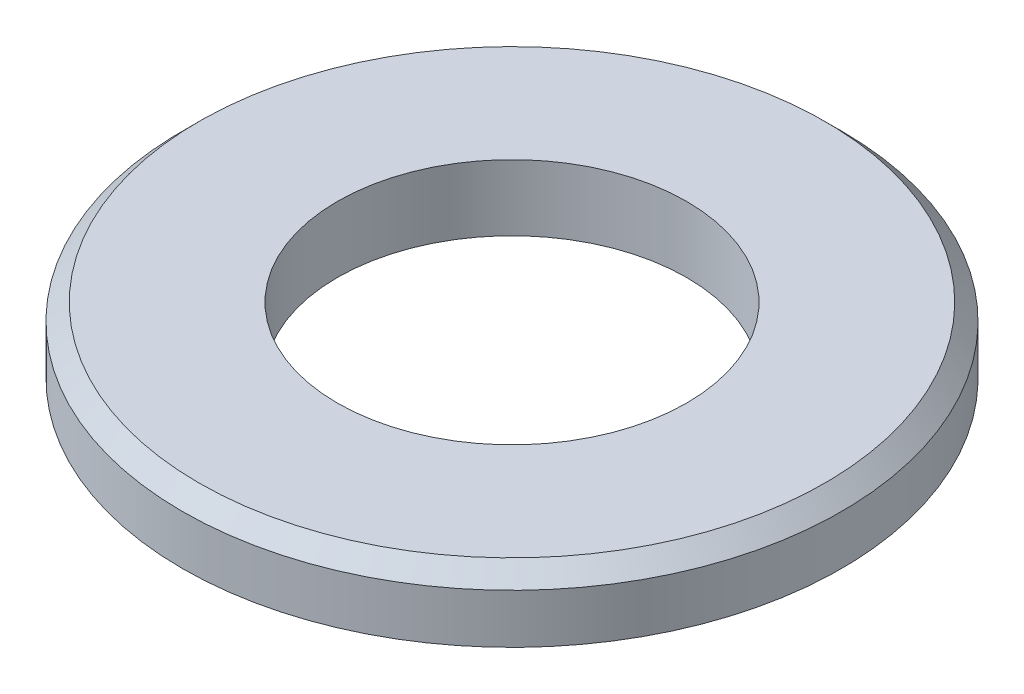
SolidWorks part; units mm, degrees
ref_plane "Face" through (0, 0, 0) normal (0, 0, 1) x (1, 0, 0)
ref_plane "Dessus" through (0, 0, 0) normal (0, 1, 0) x (1, 0, 0)
ref_plane "Droite" through (0, 0, 0) normal (1, 0, 0) x (0, 0, -1)
sketch "Esquisse1" plane through (0, 0, 0) normal (0, 1, 0) x (1, 0, 0)
  circle A0 centre (0, 0) radius 5
  circle A1 centre (0, 0) radius 2.65
  dimension "D2" = 10
  dimension "d1" = 5.3
extrude "Base-Extrusion" add sketch "Esquisse1" along normal blind 1
chamfer "Chanfrein3" distance 0.25 angle 45 1 edges at (0, 1, 5)
equation "\"D1@Chanfrein3\" = \"e@Base-Extrusion\"/4"
